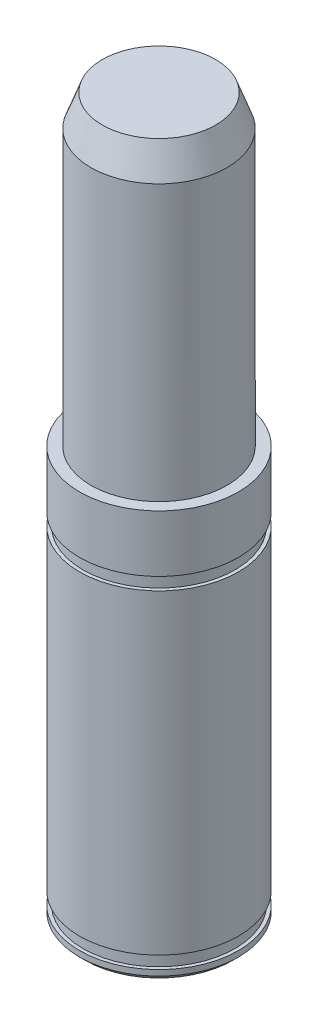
SolidWorks part; units mm, degrees
ref_plane "Face" through (0, 0, 0) normal (0, 0, 1) x (1, 0, 0)
ref_plane "Dessus" through (0, 0, 0) normal (0, 1, 0) x (1, 0, 0)
ref_plane "Droite" through (0, 0, 0) normal (1, 0, 0) x (0, 0, -1)
sketch "Esquisse1" plane through (0, 0, 0) normal (0, 0, 1) x (1, 0, 0)
  line L0 (0, 78.4281) -> (0, -104.068) construction
  line L1 (0, 27) -> (6, 27)
  line L2 (6, 27) -> (6, 0)
  line L3 (6, 0) -> (7, 0)
  line L4 (7, 0) -> (7, -5)
  line L5 (7, -36) -> (0, -36)
  line L6 (7, -35) -> (6.7, -35)
  line L7 (6.7, -35) -> (6.7, -33.9)
  line L8 (6.7, -33.9) -> (7, -33.9)
  line L9 (7, -6.1) -> (6.7, -6.1)
  line L10 (6.7, -6.1) -> (6.7, -5)
  line L11 (6.7, -5) -> (7, -5)
  line L12 (7, -35) -> (7, -36)
  line L13 (7, -6.1) -> (7, -33.9)
  line L14 (0, 27) -> (0, -36)
  dimension "D1" = 63
  dimension "D2" = 36
  dimension "D3" = 14
  dimension "D4" = 12
  dimension "D5" = 13.4
  dimension "D6" = 1.1
  dimension "D7" = 5
  dimension "D8" = 30
  dimension "D9" = 1
  dimension "D10" = 27
revolve "Base-Révolution" add sketch "Esquisse1" angle 360 about L0
chamfer "Chanfrein1" distance 2.75 angle 20 1 edges at (0, 27, 6)
chamfer "Chanfrein2" distance 0.5 angle 45 1 edges at (0, -36, 7)
